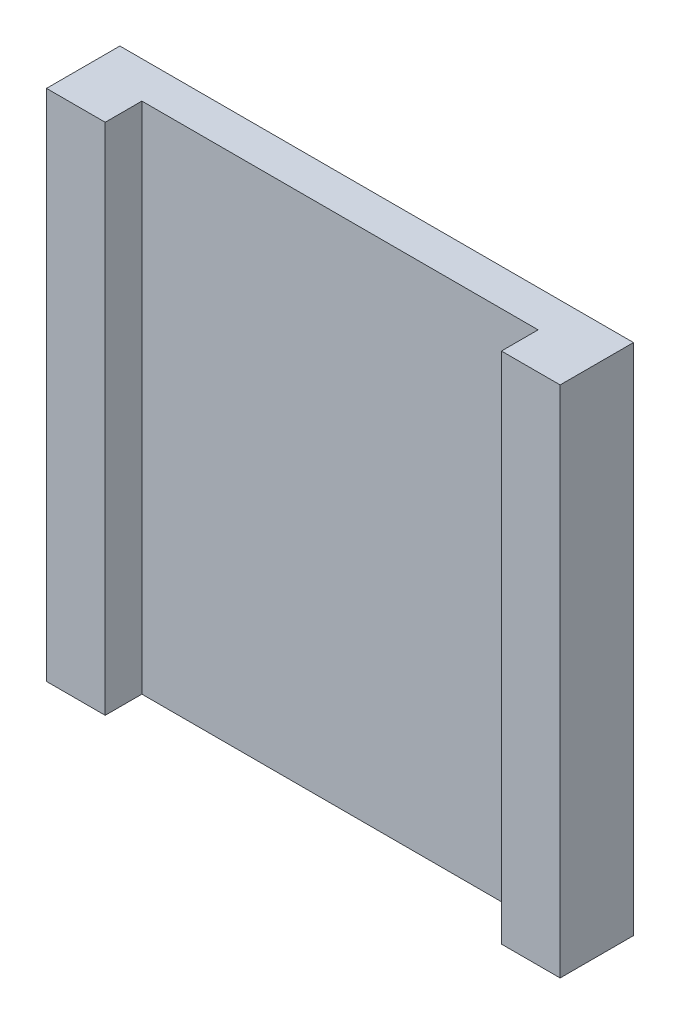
SolidWorks part; units mm, degrees
ref_plane "Front" through (0, 0, 0) normal (0, 0, 1) x (1, 0, 0)
ref_plane "Top" through (0, 0, 0) normal (0, 1, 0) x (1, 0, 0)
ref_plane "Right" through (0, 0, 0) normal (1, 0, 0) x (0, 0, -1)
sketch "Sketch1" plane through (0, 0, 0) normal (0, 0, 1) x (1, 0, 0)
  line L1 (0, 0) -> (88.9, 0)
  line L2 (0, 0) -> (0, 88.9)
  line L3 (0, 88.9) -> (88.9, 88.9)
  line L4 (88.9, 0) -> (88.9, 88.9)
  dimension "D1" = 88.9
  dimension "D2" = 88.9
extrude "Extrude1" add sketch "Sketch1" along normal blind 12.7
sketch "Sketch2" plane through (0, 0, 12.7) normal (0, 0, 1) x (1, 0, 0)
  line L12 (10.16, 98.2603) -> (10.16, -10.1851)
  line L13 (10.16, -10.1851) -> (78.74, -10.1851)
  line L14 (78.74, -10.1851) -> (78.74, 98.2603)
  line L15 (78.74, 98.2603) -> (10.16, 98.2603)
extrude "Cut-Extrude1" cut sketch "Sketch2" against normal blind 6.35
